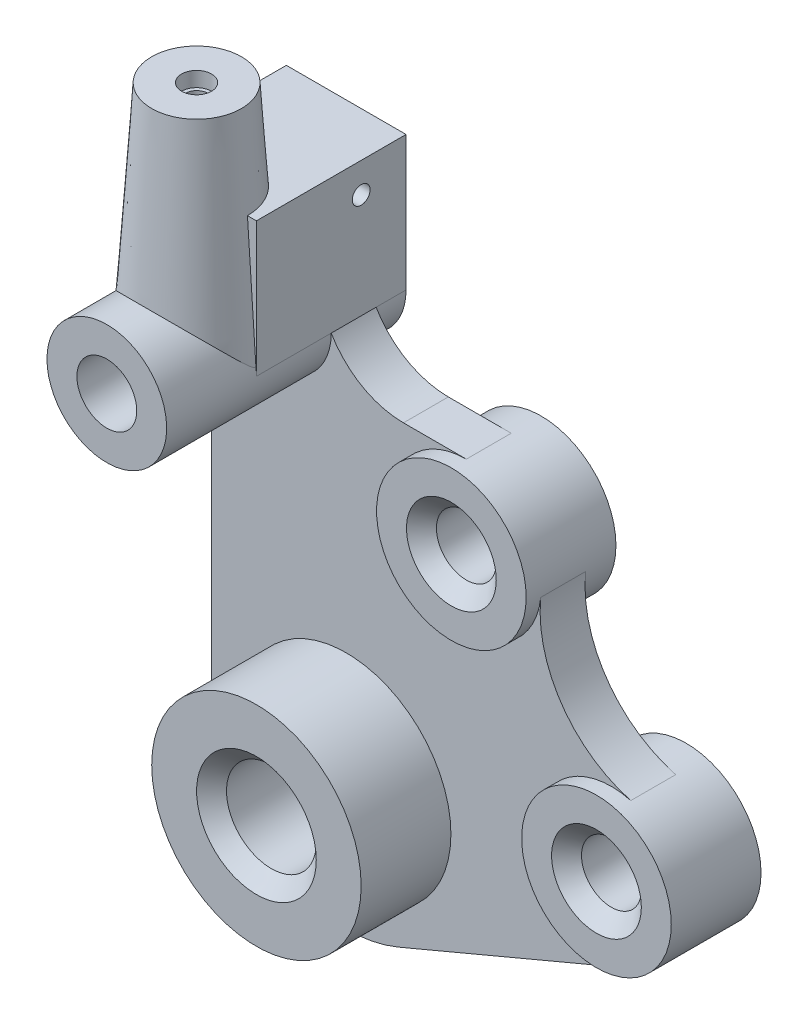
SolidWorks part; units mm, degrees
ref_plane "前视基准面" through (0, 0, 0) normal (0, 0, 1) x (1, 0, 0)
ref_plane "上视基准面" through (0, 0, 0) normal (0, 1, 0) x (1, 0, 0)
ref_plane "右视基准面" through (0, 0, 0) normal (1, 0, 0) x (0, 0, -1)
sketch "草图1" plane through (0, 0, 0) normal (0, 0, 1) x (1, 0, 0)
  line L0 (0, 0) -> (47.3229, 8.3443) construction
  line L1 (0, 0) -> (20.6972, 44.3853) construction
  circle A2 centre (17.7265, 3.1257) radius 2
  circle A3 centre (17.7265, 3.1257) radius 5
  circle A4 centre (8.0297, 17.2198) radius 2
  circle A5 centre (8.0297, 17.2198) radius 5
  dimension "D1" = 18
  dimension "D2" = 19
extrude "拉伸1" add sketch "草图1" along normal blind 6
sketch "草图2" plane through (0, 0, 0) normal (0, 0, 1) x (1, 0, 0)
  circle A0 centre (0, 0) radius 3
  circle A1 centre (0, 0) radius 7
extrude "拉伸2" add sketch "草图2" along normal blind 11
ref_plane "基准面2" through (0, 0, 2) normal (0, 0, -1) x (-1, 0, 0)
sketch "草图6" plane through (0, 0, 2) normal (0, 0, -1) x (-1, 0, 0)
  line L0 (-19.6673, -1.4823) -> (-3.4934, -8.2944)
  line L1 (9, 0) -> (9, 25)
  line L2 (9, 25) -> (1, 25)
  line L3 (-8.0297, 22.2198) -> (-3.8278, 22.2198)
  arc A0 (9, 0) -> (-3.4934, -8.2944) centre (0, 0) cw
  circle A1 centre (-17.7265, 3.1257) radius 5 construction
  arc A2 (-13.0031, 16.7047) -> (-19.0232, 7.9546) centre (-21.1463, 15.8613) cw
  circle A3 centre (-8.0297, 17.2198) radius 5 construction
  arc A4 (1, 25) -> (-3.8278, 22.2198) centre (-3.8278, 27.8017) cw
  arc A5 (-13.0031, 16.7047) -> (-8.0297, 22.2198) centre (-8.0297, 17.2198) ccw
  arc A6 (-19.6673, -1.4823) -> (-19.0232, 7.9546) centre (-17.7265, 3.1257) ccw
extrude "拉伸5" add sketch "草图6" against normal blind 3
sketch "草图7" plane through (0, 0, 0) normal (0, 0, -1) x (-1, 0, 0)
  line L0 (9, 25) -> (1, 25) construction
  circle A0 centre (5, 25) radius 4
  circle A1 centre (5, 25) radius 1
extrude "拉伸6" add sketch "草图7" against normal blind 16
ref_plane "基准面3" through (0, 0, 10) normal (0, 0, -1) x (-1, 0, 0)
sketch "草图9" plane through (0, 0, 10) normal (0, 0, -1) x (-1, 0, 0)
  line L0 (5, 25) -> (5, 32.1652) construction
  line L1 (6, 25) -> (4, 25) construction
  line L2 (5, 25) -> (1, 25)
  line L3 (1, 25) -> (2, 40)
  line L4 (2, 40) -> (5, 40)
  line L5 (5, 40) -> (5, 25)
revolve "旋转1" add sketch "草图9" angle 360 about L5
sketch "草图10" plane through (0, 0, 0) normal (0, 0, -1) x (-1, 0, 0)
  line L0 (1, 25) -> (9, 25)
  line L1 (9, 25) -> (9, 34)
  line L2 (9, 34) -> (1, 34)
  line L3 (1, 34) -> (1, 25)
  circle A0 centre (5, 25) radius 4 construction
extrude "拉伸7" add sketch "草图10" against normal blind 10
sketch "草图11" plane through (0, 0, 16) normal (0, 0, 1) x (1, 0, 0)
  circle A0 centre (-5, 25) radius 1
extrude "切除-拉伸1" cut sketch "草图11" against normal through all
sketch "草图12" plane through (0, 0, 16) normal (0, 0, 1) x (1, 0, 0)
  circle A0 centre (-5, 25) radius 2
extrude "切除-拉伸2" cut sketch "草图12" against normal blind 7
hole_wizard "#0-80 螺纹孔1" positions "3D草图1" profile "草图13" tap size "#0-80" standard "Ansi Inch"
sketch3d "3D草图1"
  line L0 (-9, 34, 10) -> (-9, 34, 0) construction
  line L1 (-9, 25, 0) -> (-9, 34, 0) construction
  point P0 (-9, 32, 3)
  dimension "D1" = 2
  dimension "D2" = 3
sketch "草图13" plane through (-9, 32, 3) normal (0, 1, 0) x (0, 0, 1)
  line L0 (0, 0) -> (0, 10.3579)
  line L1 (0, 10.3579) -> (0.5956, 10)
  line L2 (0.5956, 10) -> (0.5956, 0)
  line L5 (0.5956, 0) -> (0, 0)
  line L10 (0, 10.3579) -> (-0.5956, 10) construction
  line L11 (0, -6.35) -> (0, 107.95) construction
  dimension "蹟恇謂郰芛眻噤" = 1.1913
  dimension "蹟恇謂郰芛旮僅" = 10
  dimension "絳芛褒僅" = 118
hole_wizard "#0-80 螺纹孔2" positions "3D草图2" profile "草图17" tap size "#0-80" standard "PCS"
sketch3d "3D草图2"
  line L0 (-5, 34, 10) -> (-5, 40, 10) construction
  point P0 (-5, 40, 10)
sketch "草图17" plane through (-5, 40, 10) normal (1, 0, 0) x (0, 0, 1)
  line L0 (0, 0) -> (0, 4.3584)
  line L1 (0, 4.3584) -> (0.5956, 4.0005)
  line L2 (0.5956, 4.0005) -> (0.5956, 3.048)
  line L3 (0.5956, 3.048) -> (0.762, 3.048)
  line L4 (0.762, 3.048) -> (0.762, 0)
  line L5 (0.762, 0) -> (0, 0)
  line L10 (0, 4.3584) -> (-0.5956, 4.0005) construction
  line L11 (0, -6.35) -> (0, 107.95) construction
  dimension "蹟恇謂郰芛眻噤" = 1.1913
  dimension "蹟恇謂郰芛旮僅" = 4.0005
  dimension "蹟恇翋眻噤" = 1.524
  dimension "蹟恇旮僅" = 3.048
  dimension "絳芛褒僅" = 118
sketch "草图18" plane through (0, 40, 0) normal (0, 1, 0) x (1, 0, 0)
  circle A0 centre (-5, -10) radius 1
extrude "切除-拉伸3" cut sketch "草图18" against normal blind 1
chamfer "倒角1" distance 1 angle 45 4 edges at (3, 0, 0) (10.0297, 17.2198, 6) (19.7265, 3.1257, 6) (3, 0, 11)
